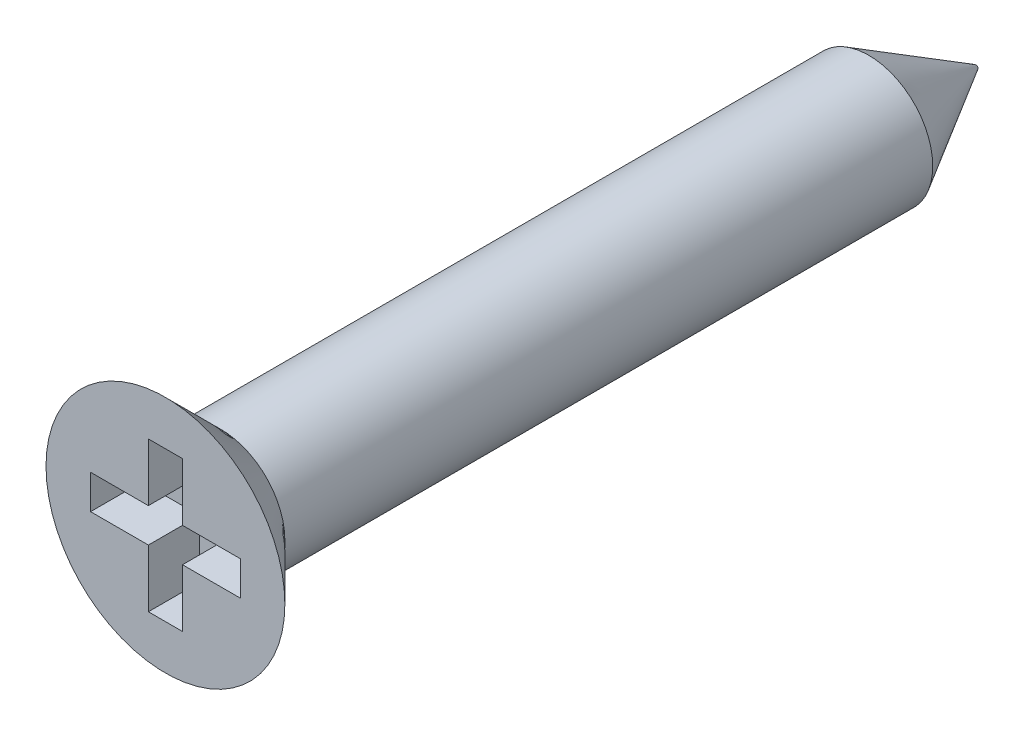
SolidWorks part; units mm, degrees
ref_plane "Plan de face" through (0, 0, 0) normal (0, 0, 1) x (1, 0, 0)
ref_plane "Plan de dessus" through (0, 0, 0) normal (0, 1, 0) x (1, 0, 0)
ref_plane "Plan de droite" through (0, 0, 0) normal (1, 0, 0) x (0, 0, -1)
sketch "Esquisse1" plane through (0, 0, 0) normal (1, 0, 0) x (0, 0, -1)
  line L0 (-1.6035, 0) -> (7.1529, 0) construction
  line L1 (0, 5.0438) -> (0, -4.594) construction
  line L2 (0, 2.8) -> (1.3, 1.5)
  line L3 (1.3, 1.5) -> (1.3, 0)
  line L4 (-1.442, 2.8) -> (2.7621, 2.8) construction
  line L5 (0, 2.8) -> (8.0274, -5.2274) construction
  line L6 (-1.0988, 1.5) -> (4.1029, 1.5) construction
  line L7 (1.3, 0) -> (0, 0)
  line L9 (0, 2.8) -> (0, 0)
revolve "Révolution2" add sketch "Esquisse1" angle 360 about L0
sketch "Esquisse3" plane through (0, 0, 0) normal (0, 0, 1) x (1, 0, 0)
  circle A0 centre (0, 0) radius 1.5
extrude "Extrusion1" add sketch "Esquisse3" against normal blind 19
sketch "Esquisse2" plane through (0, 0, 0) normal (0, 0, 1) x (1, 0, 0)
  line L0 (0.4, -0.4) -> (1.755, -0.4)
  line L1 (0.4, 0.4) -> (1.755, 0.4)
  line L2 (-1.755, -0.4) -> (-0.4, -0.4)
  line L3 (-0.4, 1.755) -> (-0.4, 0.4)
  line L4 (-1.755, 0.4) -> (-0.4, 0.4)
  line L5 (0.4, 1.755) -> (0.4, 0.4)
  line L6 (-0.4, 1.755) -> (0.4, 1.755)
  line L7 (1.755, 0.4) -> (1.755, -0.4)
  line L8 (0.4, -1.755) -> (-0.4, -1.755)
  line L9 (-1.755, -0.4) -> (-1.755, 0.4)
  line L10 (-0.4, -0.4) -> (-0.4, -1.755)
  line L12 (0.4, -0.4) -> (0.4, -1.755)
  circle A0 centre (0, 0) radius 1.8 construction
extrude "Enlèv. mat.-Extru.2" cut sketch "Esquisse2" against normal blind 1.2
chamfer "Chanfrein1" distance 1.45 angle 60 1 edges at (1.5, 0, -19)
